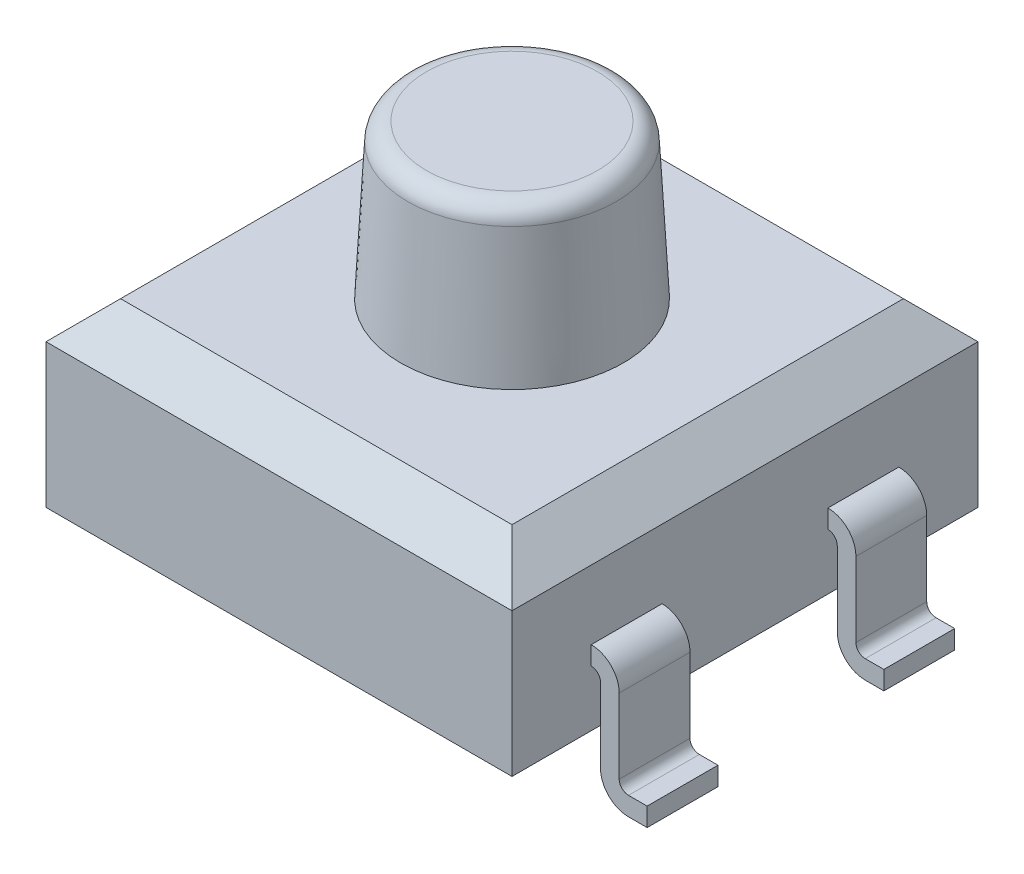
SolidWorks part; units mm, degrees
ref_plane "Front" through (0, 0, 0) normal (0, 0, 1) x (1, 0, 0)
ref_plane "Top" through (0, 0, 0) normal (0, 1, 0) x (1, 0, 0)
ref_plane "Right" through (0, 0, 0) normal (1, 0, 0) x (0, 0, -1)
sketch "Эскиз1" plane through (0, 0, 0) normal (1, 0, 0) x (0, 0, -1)
  line L0 (0, 0) -> (0, 2.54) construction
  line L1 (-2.5, 0.2) -> (2.5, 0.2)
  line L2 (-2.5, 0.2) -> (-2.5, 2.54)
  line L3 (-2.5, 2.54) -> (2.5, 2.54)
  line L4 (2.5, 0.2) -> (2.5, 2.54)
  dimension "D1" = 0.2
  dimension "D2" = 2.54
  dimension "D3" = 5
extrude "Вытянуть1" add sketch "Эскиз1" along normal mid plane 5
ref_plane "Плоскость1" through (-1.27, 0, 0) normal (1, 0, 0) x (0, 0, -1)
sketch "Эскиз2" plane through (-1.27, 0, 0) normal (0, 0, 1) x (1, 0, 0)
  line L0 (-1.23, 1.2) -> (3.77, 1.2)
  line L1 (3.87, 1.1) -> (3.87, 0.3)
  line L2 (4.17, 0) -> (4.37, 0)
  line L3 (1.27, 0) -> (1.27, 1.2) construction
  line L4 (-1.23, 1.4) -> (3.77, 1.4)
  line L5 (4.07, 1.1) -> (4.07, 0.3)
  line L6 (4.17, 0.2) -> (4.37, 0.2)
  line L7 (4.37, 0) -> (4.37, 0.2)
  line L8 (3.77, 0.2) -> (3.77, 2.54) construction
  line L10 (-1.83, 0) -> (-1.83, 0.2)
  line L11 (-1.63, 0.2) -> (-1.83, 0.2)
  line L12 (-1.53, 1.1) -> (-1.53, 0.3)
  line L13 (-1.63, 0) -> (-1.83, 0)
  line L14 (-1.33, 1.1) -> (-1.33, 0.3)
  line L15 (3.77, 0.2) -> (-1.23, 0.2) construction
  arc A0 (3.87, 0.3) -> (4.17, 0) centre (4.17, 0.3) ccw
  arc A1 (3.77, 1.2) -> (3.87, 1.1) centre (3.77, 1.1) cw
  arc A2 (3.77, 1.4) -> (4.07, 1.1) centre (3.77, 1.1) cw
  arc A3 (4.07, 0.3) -> (4.17, 0.2) centre (4.17, 0.3) ccw
  arc A4 (-1.53, 0.3) -> (-1.63, 0.2) centre (-1.63, 0.3) cw
  arc A5 (-1.23, 1.4) -> (-1.53, 1.1) centre (-1.23, 1.1) ccw
  arc A6 (-1.23, 1.2) -> (-1.33, 1.1) centre (-1.23, 1.1) ccw
  arc A7 (-1.33, 0.3) -> (-1.63, 0) centre (-1.63, 0.3) cw
  dimension "D2" = 0.3
  dimension "D3" = 0.1
  dimension "D1" = 6.2
  dimension "D5" = 0.1
  dimension "D6" = 1
  dimension "D4" = 0.2
extrude "Вытянуть2" add sketch "Эскиз2" along normal mid plane 0.76 from offset 1.27
mirror "Зеркальное отражение1" about plane through (0, 0, 0) normal (0, 0, 1) of "Вытянуть2"
sketch "Эскиз3" plane through (0, 2.54, 0) normal (0, 1, 0) x (-1, 0, 0)
  circle A0 centre (0, 0) radius 1.195
  dimension "D1" = 2.39
extrude "Вытянуть3" add sketch "Эскиз3" along normal blind 1.65 draft 3
chamfer "Фаска1" distance 0.4 angle 45 8 edges at (0, 2.54, -2.5) (2.5, 2.54, 0) (0, 2.54, 2.5) (-2.5, 2.54, 0) (0, 0.2, 2.5) (2.5, 0.2, 0) (0, 0.2, -2.5) (-2.5, 0.2, 0)
fillet "Скругление1" radius 0.2 1 edges at (0, 4.19, 1.1085)
